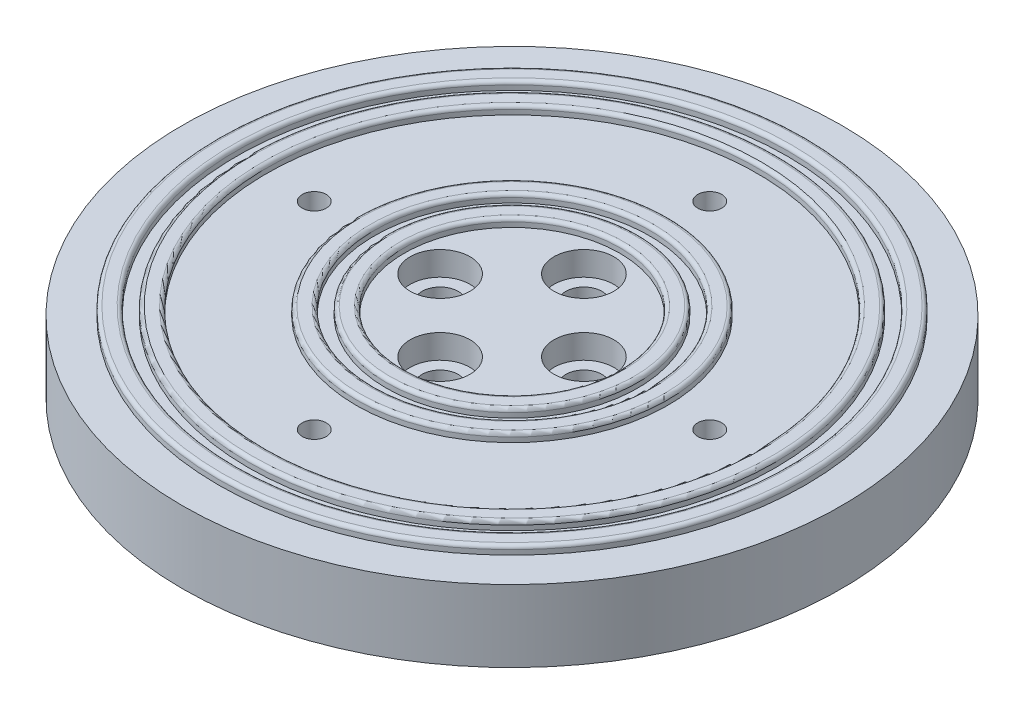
SolidWorks part; units mm, degrees
ref_plane "Front Plane" through (0, 0, 0) normal (0, 0, 1) x (1, 0, 0)
ref_plane "Top Plane" through (0, 0, 0) normal (0, 1, 0) x (1, 0, 0)
ref_plane "Right Plane" through (0, 0, 0) normal (1, 0, 0) x (0, 0, -1)
sketch "Sketch1"
  circle A5 centre (0, 0) radius 22.5 construction
  circle A6 centre (16.5, 0) radius 1
  circle A7 centre (0, -16.5) radius 1
  circle A8 centre (-16.5, 0) radius 1
  circle A9 centre (0, 16.5) radius 1
  circle A10 centre (0, 0) radius 10
  circle A11 centre (0, 0) radius 27.5
  circle A12 centre (0, 6) radius 1.5
  circle A13 centre (6, 0) radius 1.5
  circle A14 centre (0, 0) radius 10
  circle A15 centre (0, -6) radius 1.5
  circle A16 centre (0, 0) radius 10
  circle A17 centre (-6, 0) radius 1.5
  circle A18 centre (0, 0) radius 10
  point P32 (0, 0)
other "AlignGroup1" parameters "D1"=9.5876, "D3"=3.2235, "D7"=45, "D8"=55, "D9"=2, "D4"=4.2135, "D6"=0, "D10"=16.5, "D11"=6, "D12"=16.5, "D13"=16.5, "D2"=5, "D5"=4
other "AlignGroup2"
extrude "Boss-Extrude1" add sketch "Sketch1" against normal blind 6
sketch "Sketch3" plane through (0, 0, 0) normal (0, 1, 0) x (1, 0, 0)
  circle A0 centre (0, -6) radius 1.5 construction
  circle A1 centre (6, 0) radius 1.5 construction
  circle A2 centre (-6, 0) radius 1.5 construction
  circle A3 centre (0, 6) radius 1.5 construction
  circle A4 centre (0, -6) radius 1.5 construction
  circle A5 centre (6, 0) radius 1.5 construction
  circle A6 centre (-6, 0) radius 1.5 construction
  circle A7 centre (0, 6) radius 1.5 construction
  circle A8 centre (0, -6) radius 2.5
  circle A9 centre (6, 0) radius 2.5
  circle A10 centre (-6, 0) radius 2.5
  circle A11 centre (0, 6) radius 2.5
  dimension "D1" = 1
extrude "Cut-Extrude2" cut sketch "Sketch3" against normal blind 2
sketch "Sketch4" plane through (0, 0, 0) normal (0, 1, 0) x (1, 0, 0)
  circle A0 centre (0, 0) radius 27.5 construction
  circle A1 centre (0, 0) radius 27.5
  circle A2 centre (0, 0) radius 11 construction
  circle A3 centre (0, 0) radius 11.5
  circle A4 centre (0, 0) radius 10.5
  circle A5 centre (0, 0) radius 9
  circle A6 centre (0, 0) radius 13
  circle A7 centre (0, 0) radius 22.5 construction
  circle A8 centre (0, 0) radius 23
  circle A9 centre (0, 0) radius 22
  circle A10 centre (0, 0) radius 24.5
  circle A11 centre (0, 0) radius 20.5
  dimension "D1" = 22
  dimension "D6" = 45
  dimension "D2" = 0.5
  dimension "D3" = 0.5
  dimension "D4" = 1.5
  dimension "D5" = 1.5
  dimension "D7" = 0.5
  dimension "D8" = 0.5
  dimension "D9" = 1.5
  dimension "D10" = 1.5
extrude "Boss-Extrude2" add sketch "Sketch4" along normal blind 0.7 contours A10 A8 | A9 A11 | A6 A3 | A4 A5
fillet "Fillet1" radius 0.3 8 edges at (0, 0.7, 13) (0, 0.7, 11.5) (0, 0.7, 10.5) (0, 0.7, 9) (0, 0.7, 24.5) (0, 0.7, 23) (0, 0.7, 22) (0, 0.7, 20.5)
